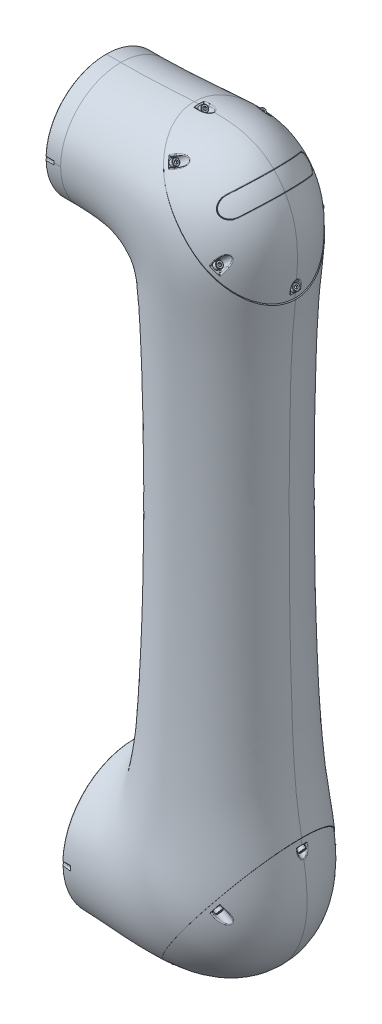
SolidWorks part; units mm, degrees
other "NONE"
ref_plane "前视基准面" through (0, 0, 0) normal (0, 0, 1) x (1, 0, 0)
ref_plane "上视基准面" through (0, 0, 0) normal (0, 1, 0) x (1, 0, 0)
ref_plane "右视基准面" through (0, 0, 0) normal (1, 0, 0) x (0, 0, -1)
imported_body "输入1"
sketch "草图1" plane through (92, 0, 0) normal (-1, 0, 0) x (0, 0, 1)
  circle A0 centre (-0.0026, 186.5) radius 46.7617
extrude "切除-拉伸1" cut sketch "草图1" against normal blind 0.5
sketch "草图2" plane through (68, 0, 0) normal (-1, 0, 0) x (0, 0, 1)
  circle A0 centre (0, 676.5003) radius 40.3406
extrude "切除-拉伸2" cut sketch "草图2" against normal blind 0.5
